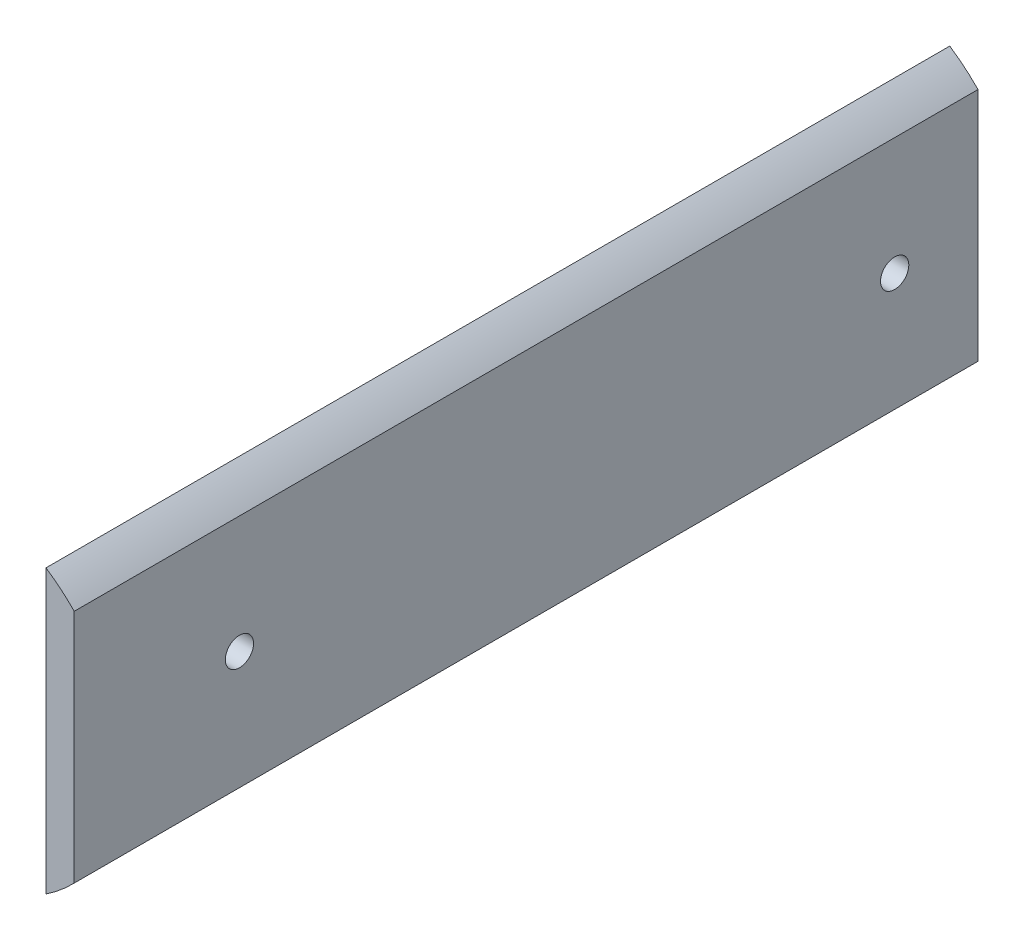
SolidWorks part; units mm, degrees
ref_plane "Front Plane" through (0, 0, 0) normal (0, 0, 1) x (1, 0, 0)
ref_plane "Top Plane" through (0, 0, 0) normal (0, 1, 0) x (1, 0, 0)
ref_plane "Right Plane" through (0, 0, 0) normal (1, 0, 0) x (0, 0, -1)
inserted part "Part 1<8>@Assem1"
